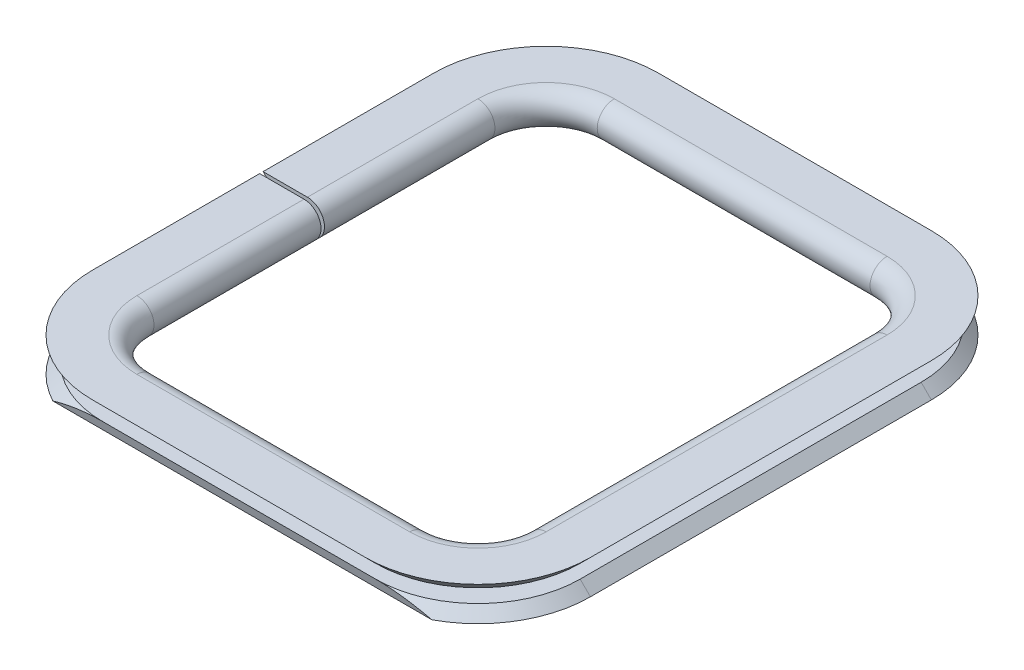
SolidWorks part; units mm, degrees
ref_plane "Plan de face" through (0, 0, 0) normal (0, 0, 1) x (1, 0, 0)
ref_plane "Plan de dessus" through (0, 0, 0) normal (0, 1, 0) x (1, 0, 0)
ref_plane "Plan de droite" through (0, 0, 0) normal (1, 0, 0) x (0, 0, -1)
sketch "Esquisse1" plane through (0, 0, 0) normal (0, 0, 1) x (1, 0, 0)
  line L0 (0, 0) -> (32.6326, 0) construction
  line L1 (0, -1) -> (0, 1)
  line L2 (0, 1) -> (-5, 1)
  line L3 (-5, 1) -> (-6.5, 2.5)
  line L4 (-6.5, 2.5) -> (0, 2.5)
  line L5 (-6.5, -2.5) -> (0, -2.5)
  line L6 (-5, -1) -> (-6.5, -2.5)
  line L7 (0, -1) -> (-5, -1)
  arc A0 (0, 2.5) -> (0, -2.5) centre (0, 0) cw
  dimension "D1" = 1
  dimension "D2" = 45
  dimension "D3" = 1.5
  dimension "D4" = 6.5
sketch "Esquisse2" plane through (0, 0, 0) normal (0, 1, 0) x (1, 0, 0)
  line L0 (0, 0) -> (0, 25)
  line L1 (10, 35) -> (50, 35)
  line L2 (60, 25) -> (60, -25)
  line L3 (50, -35) -> (10, -35)
  line L4 (0, -25) -> (0, -0.5)
  line L6 (0, 0) -> (32.6326, 0) construction
  arc A0 (0, 25) -> (10, 35) centre (10, 25) cw
  arc A1 (50, 35) -> (60, 25) centre (50, 25) cw
  arc A2 (60, -25) -> (50, -35) centre (50, -25) cw
  arc A3 (10, -35) -> (0, -25) centre (10, -25) cw
  point P15 (60, -35)
  point P18 (0, -35)
  dimension "D5" = 10
  dimension "D1" = 70
  dimension "D2" = 60
  dimension "D3" = 0.5
  dimension "D4" = 35
sweep "Balayage1" add profiles "Esquisse1" path "Esquisse2"
sketch "Esquisse3" plane through (0, 0, 0) normal (1, 0, 0) x (0, 0, -1)
  line L5 (-40, -1) -> (-43.9566, -1)
  line L6 (-43.9566, -1) -> (-43.9566, -4.1308)
  line L7 (-43.9566, -4.1308) -> (-39.0428, -4.1308)
  line L8 (-39.0428, -4.1308) -> (-40, -1)
  line L9 (-25, -1) -> (-40, -1) construction
  dimension "D3" = 73
extrude "Enlèv. mat.-Extru.1" cut sketch "Esquisse3" against normal through all and the other way through all
